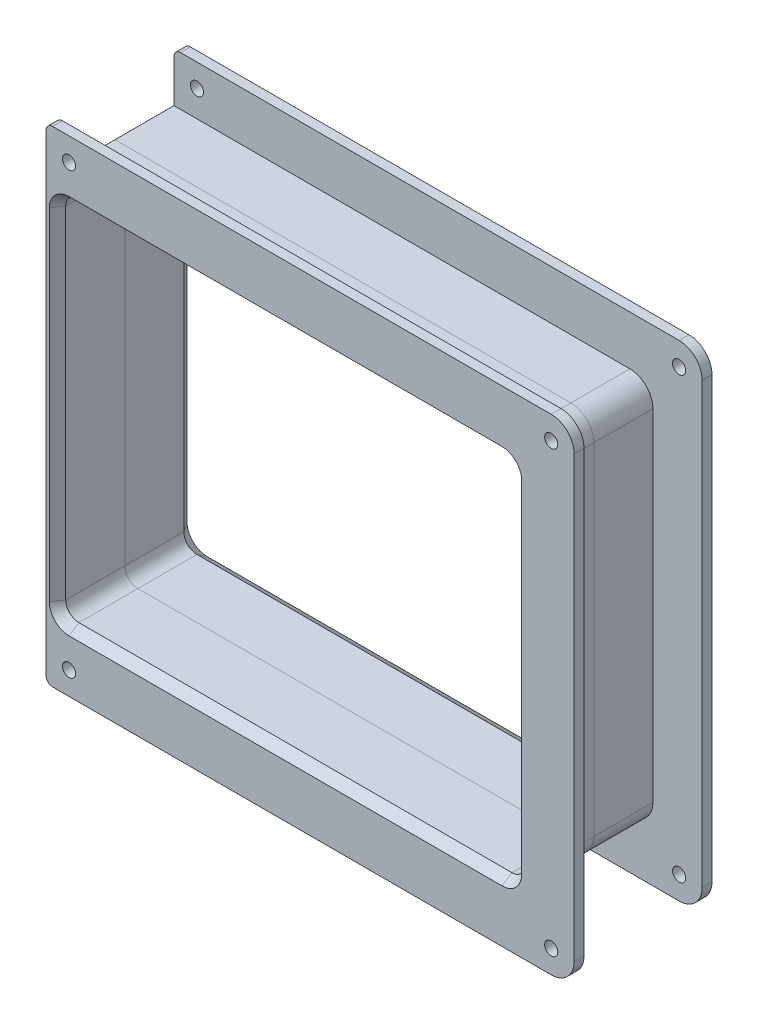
SolidWorks part; units mm, degrees
ref_plane "Спереди" through (0, 0, 0) normal (0, 0, 1) x (1, 0, 0)
ref_plane "Сверху" through (0, 0, 0) normal (0, 1, 0) x (1, 0, 0)
ref_plane "Справа" through (0, 0, 0) normal (1, 0, 0) x (0, 0, -1)
sketch "Эскиз1" plane through (0, 0, 0) normal (1, 0, 0) x (0, 0, -1)
  line L0 (0, 0) -> (0, 118) construction
  line L1 (0, 0) -> (-21, 0)
  line L2 (0, 0) -> (0, 3)
  line L3 (0, 3) -> (-21, 3)
  line L4 (-21, 0) -> (-21, 3)
  line L5 (0, 115) -> (-21, 115)
  line L6 (0, 115) -> (0, 118)
  line L7 (0, 118) -> (-21, 118)
  line L8 (-21, 115) -> (-21, 118)
  line L9 (0, 7) -> (-15, 13.9946)
  line L10 (-15, 13.9946) -> (-15, 16.9946)
  line L11 (-15, 16.9946) -> (0, 10)
  line L12 (0, 10) -> (0, 7)
  line L13 (-15, 27.2803) -> (-15, 30.2803)
  line L14 (-15, 30.2803) -> (0, 23.2857)
  line L15 (0, 23.2857) -> (0, 20.2857)
  line L16 (0, 20.2857) -> (-15, 27.2803)
  line L17 (-15, 40.566) -> (-15, 43.566)
  line L18 (-15, 43.566) -> (0, 36.5714)
  line L19 (0, 36.5714) -> (0, 33.5714)
  line L20 (0, 33.5714) -> (-15, 40.566)
  line L21 (-15, 53.8518) -> (-15, 56.8518)
  line L22 (-15, 56.8518) -> (0, 49.8571)
  line L23 (0, 49.8571) -> (0, 46.8571)
  line L24 (0, 46.8571) -> (-15, 53.8518)
  line L25 (-15, 67.1375) -> (-15, 70.1375)
  line L26 (-15, 70.1375) -> (0, 63.1429)
  line L27 (0, 63.1429) -> (0, 60.1429)
  line L28 (0, 60.1429) -> (-15, 67.1375)
  line L29 (-15, 80.4232) -> (-15, 83.4232)
  line L30 (-15, 83.4232) -> (0, 76.4286)
  line L31 (0, 76.4286) -> (0, 73.4286)
  line L32 (0, 73.4286) -> (-15, 80.4232)
  line L49 (-15, 93.7089) -> (-15, 96.7089)
  line L50 (-15, 96.7089) -> (0, 89.7143)
  line L51 (0, 89.7143) -> (0, 86.7143)
  line L52 (0, 86.7143) -> (-15, 93.7089)
  line L53 (-15, 106.9946) -> (-15, 109.9946)
  line L54 (-15, 109.9946) -> (0, 103)
  line L55 (0, 103) -> (0, 100)
  line L56 (0, 100) -> (-15, 106.9946)
  dimension "D2" = 118
  dimension "D3" = 3
  dimension "D4" = 21
  dimension "D5" = 4
  dimension "D6" = 12
  dimension "D7" = 15
  dimension "D8" = 65
  dimension "D9" = 3.2911
  dimension "D1" = 8
extrude "Бобышка-Вытянуть1" add sketch "Эскиз1" along normal blind 146
sketch "Эскиз2" plane through (0, 0, 0) normal (0, 0, -1) x (-1, 0, 0)
  line L0 (-146, 0) -> (0, 0) construction
  line L1 (-146, 118) -> (-143, 118)
  line L2 (-146, 118) -> (-146, 0)
  line L3 (-146, 0) -> (-143, 0)
  line L4 (-143, 118) -> (-143, 0)
  line L6 (0, 118) -> (-3, 118)
  line L7 (0, 118) -> (0, 0)
  line L8 (0, 0) -> (-3, 0)
  line L9 (-3, 118) -> (-3, 0)
  dimension "D1" = 3
  dimension "D2" = 3
extrude "Бобышка-Вытянуть2" add sketch "Эскиз2" against normal up to surface (21 mm away)
sketch "Эскиз3" plane through (0, 0, 0) normal (0, 0, -1) x (-1, 0, 0)
  line L0 (0, 59) -> (-146, 59) construction
  line L1 (-161, 0) -> (0, 0)
  line L2 (-161, 0) -> (-161, -15)
  line L3 (-161, -15) -> (0, -15)
  line L4 (0, 0) -> (0, -15)
  line L5 (0, 0) -> (0, 118) construction
  line L6 (-146, 0) -> (-146, 118) construction
  line L7 (-80.5, -15) -> (-80.5, 0) construction
  line L12 (0, 118) -> (0, 133)
  line L13 (-161, 133) -> (0, 133)
  line L14 (-161, 118) -> (-161, 133)
  line L15 (-161, 118) -> (0, 118)
  circle A2 centre (-154, -8) radius 2
  circle A3 centre (-7, -8) radius 2
  circle A6 centre (-7, 126) radius 2
  circle A7 centre (-154, 126) radius 2
extrude "Бобышка-Вытянуть3" add sketch "Эскиз3" against normal blind 3
sketch "Эскиз4" plane through (0, 0, 0) normal (0, 0, -1) x (-1, 0, 0)
  line L1 (-161, 118) -> (-146, 118)
  line L2 (-161, 118) -> (-161, 0)
  line L3 (-161, 0) -> (-146, 0)
  line L4 (-146, 118) -> (-146, 0)
extrude "Бобышка-Вытянуть4" add sketch "Эскиз4" against normal up to surface (3 mm away)
sketch "Эскиз5" plane through (0, 0, 0) normal (0, 0, -1) x (-1, 0, 0)
  line L1 (-143, 115) -> (-3, 115)
  line L2 (-143, 115) -> (-143, 3)
  line L3 (-143, 3) -> (-3, 3)
  line L4 (-3, 115) -> (-3, 3)
extrude "Вырез-Вытянуть1" cut sketch "Эскиз5" against normal through all
fillet "Скругление2" radius 4 4 edges at (3, 115, 10.5) (3, 3, 10.5) (143, 3, 10.5) (143, 115, 10.5)
fillet "Скругление3" radius 7 2 edges at (161, 133, 1.5) (161, -15, 1.5)
fillet "Скругление4" radius 7 2 edges at (146, 0, 12) (146, 118, 12)
fillet "Скругление5" radius 3 8 edges at (141.8284, 4.1716, 0) (73, 3, 0) (4.1716, 4.1716, 0) (4.1716, 113.8284, 0) (73, 115, 0) (141.8284, 113.8284, 0) (143, 59, 0) (3, 59, 0)
fillet "Скругление6" radius 2 2 edges at (0, -15, 1.5) (0, 133, 1.5)
mirror "Зеркальное отражение1" about plane through (146, 0, 21) normal (0, 0, -1)
equation "\"D4@Эскиз3\"=\"D3@Эскиз3\""
equation "\"D2@Эскиз3\"=\"D1@Эскиз3\""
